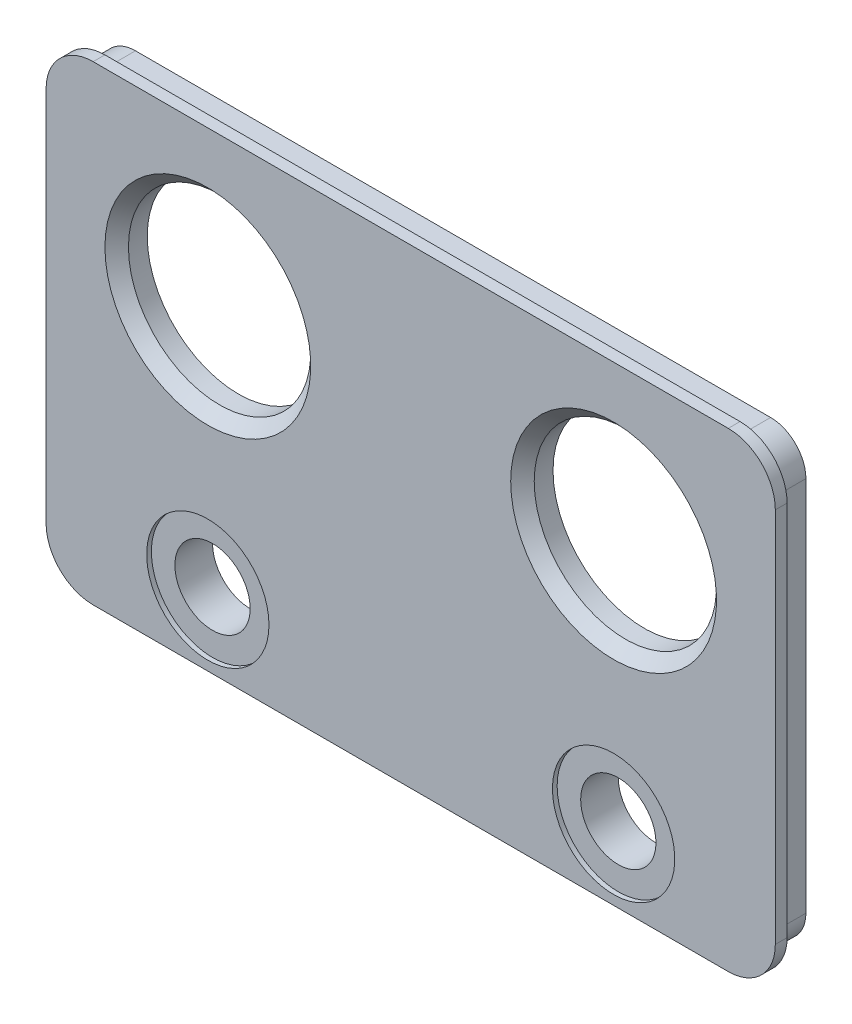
SolidWorks part; units mm, degrees
ref_plane "Front Plane" through (0, 0, 0) normal (0, 0, 1) x (1, 0, 0)
ref_plane "Top Plane" through (0, 0, 0) normal (0, 1, 0) x (1, 0, 0)
ref_plane "Right Plane" through (0, 0, 0) normal (1, 0, 0) x (0, 0, -1)
sketch "Esquisse1" plane through (0, 0, 0) normal (0, 0, 1) x (1, 0, 0)
  line L0 (0, 100) -> (0, -100) construction
  line L1 (-135, -100) -> (135, -100)
  line L2 (-155, -80) -> (-155, 80)
  line L3 (-135, 100) -> (135, 100)
  line L4 (155, -80) -> (155, 80)
  line L5 (-155, -100) -> (155, 100) construction
  line L6 (-155, 100) -> (155, -100) construction
  arc A0 (135, 100) -> (155, 80) centre (135, 80) cw
  arc A1 (135, -100) -> (155, -80) centre (135, -80) ccw
  arc A2 (-135, -100) -> (-155, -80) centre (-135, -80) cw
  arc A3 (-155, 80) -> (-135, 100) centre (-135, 80) cw
  circle A4 centre (-86.25, -70) radius 16
  circle A5 centre (-86.25, 34.25) radius 38.75
  circle A6 centre (86.25, -70) radius 16
  circle A7 centre (86.25, 34.25) radius 38.75
  point P0 (0, 0)
  dimension "D3" = 20
  dimension "D4" = 77.5
  dimension "D7" = 32
  dimension "D1" = 310
  dimension "D2" = 200
  dimension "D5" = 65.75
  dimension "D6" = 68.75
  dimension "D8" = 30
extrude "Boss.-Extru.2" add sketch "Esquisse1" along normal blind 18
sketch "Esquisse2" plane through (0, 0, 18) normal (0, 0, 1) x (1, 0, 0)
  line L0 (0, 100) -> (0, -100) construction
  line L1 (135, 100) -> (-135, 100) construction
  line L2 (-135, -100) -> (135, -100) construction
  circle A6 centre (-86.25, -70) radius 16 construction
  circle A7 centre (-86.25, -70) radius 26
  circle A8 centre (-86.25, -70) radius 26
  circle A9 centre (-86.25, -70) radius 16
  circle A10 centre (86.25, -70) radius 16
  circle A11 centre (86.25, -70) radius 26
  dimension "D1" = 10
extrude "Enlèv. mat.-Extru.1" cut sketch "Esquisse2" against normal blind 2
chamfer "Chanfrein1" distance 5 angle 45 2 edges at (47.5, 34.25, 18) (-47.5, 34.25, 18)
sketch "Esquisse4" plane through (0, 0, 0) normal (0, 0, -1) x (-1, 0, 0)
  line L0 (0, 100) -> (0, -100) construction
  line L1 (-135, 100) -> (135, 100) construction
  line L2 (135, -100) -> (-135, -100) construction
  line L3 (-86.25, 73) -> (-86.25, -4.5) construction
  line L4 (-125, 34.25) -> (-47.5, 34.25) construction
  line L10 (-126.9086, -6.4086) -> (-45.5914, 74.9086) construction
  line L11 (-126.9086, 74.9086) -> (-45.5914, -6.4086) construction
  circle A1 centre (-86.25, 34.25) radius 38.75 construction
  arc A3 (-123.6495, 75.5832) -> (-48.8505, 75.5832) centre (-86.25, -113.3132) cw
  arc A4 (-127.5832, 71.6495) -> (-127.5832, -3.1495) centre (61.3132, 34.25) ccw
  arc A5 (-123.6495, -7.0832) -> (-48.8505, -7.0832) centre (-86.25, 181.8132) ccw
  arc A6 (-44.9168, 71.6495) -> (-44.9168, -3.1495) centre (-233.8132, 34.25) cw
  arc A7 (-48.8505, -7.0832) -> (-44.9168, -3.1495) centre (-49.8216, -2.1784) ccw
  arc A8 (-127.5832, -3.1495) -> (-123.6495, -7.0832) centre (-122.6784, -2.1784) ccw
  arc A9 (-48.8505, 75.5832) -> (-44.9168, 71.6495) centre (-49.8216, 70.6784) cw
  arc A10 (-123.6495, 75.5832) -> (-127.5832, 71.6495) centre (-122.6784, 70.6784) ccw
  arc A11 (123.6495, 75.5832) -> (48.8505, 75.5832) centre (86.25, -113.3132) ccw
  arc A12 (123.6495, 75.5832) -> (127.5832, 71.6495) centre (122.6784, 70.6784) cw
  arc A13 (127.5832, 71.6495) -> (127.5832, -3.1495) centre (-61.3132, 34.25) cw
  arc A14 (127.5832, -3.1495) -> (123.6495, -7.0832) centre (122.6784, -2.1784) cw
  arc A15 (123.6495, -7.0832) -> (48.8505, -7.0832) centre (86.25, 181.8132) cw
  arc A16 (48.8505, -7.0832) -> (44.9168, -3.1495) centre (49.8216, -2.1784) cw
  arc A17 (48.8505, 75.5832) -> (44.9168, 71.6495) centre (49.8216, 70.6784) ccw
  arc A18 (44.9168, 71.6495) -> (44.9168, -3.1495) centre (233.8132, 34.25) ccw
  point P8 (-86.25, 34.25)
  point P20 (-86.25, 79.25)
  point P21 (-86.25, -10.75)
  point P24 (-131.25, 34.25)
  point P25 (-41.25, 34.25)
  dimension "D3" = 115
  dimension "D4" = 5
  dimension "D1" = 90
  dimension "D2" = 90
extrude "Enlèv. mat.-Extru.2" cut sketch "Esquisse4" against normal blind 5
sketch "Esquisse6" plane through (0, 0, 0) normal (0, 0, -1) x (-1, 0, 0)
  line L8 (-150, 80) -> (-150, -80)
  line L9 (-135, -95) -> (135, -95)
  line L10 (150, -80) -> (150, 80)
  line L11 (135, 95) -> (-135, 95)
  line L12 (-150, 80) -> (-150, -80)
  line L13 (-135, -95) -> (135, -95)
  line L14 (150, -80) -> (150, 80)
  line L15 (135, 95) -> (-135, 95)
  line L16 (-155, 80) -> (-155, -80)
  line L17 (-135, -100) -> (135, -100)
  line L18 (155, -80) -> (155, 80)
  line L19 (135, 100) -> (-135, 100)
  line L20 (-155, 80) -> (-155, -80)
  line L21 (-135, -100) -> (135, -100)
  line L22 (155, -80) -> (155, 80)
  line L23 (135, 100) -> (-135, 100)
  arc A8 (-135, 95) -> (-150, 80) centre (-135, 80) ccw
  arc A9 (-150, -80) -> (-135, -95) centre (-135, -80) ccw
  arc A10 (135, -95) -> (150, -80) centre (135, -80) ccw
  arc A11 (150, 80) -> (135, 95) centre (135, 80) ccw
  arc A12 (-135, 95) -> (-150, 80) centre (-135, 80) ccw
  arc A13 (-150, -80) -> (-135, -95) centre (-135, -80) ccw
  arc A14 (135, -95) -> (150, -80) centre (135, -80) ccw
  arc A15 (150, 80) -> (135, 95) centre (135, 80) ccw
  arc A16 (-135, 100) -> (-155, 80) centre (-135, 80) ccw
  arc A17 (-155, -80) -> (-135, -100) centre (-135, -80) ccw
  arc A18 (135, -100) -> (155, -80) centre (135, -80) ccw
  arc A19 (155, 80) -> (135, 100) centre (135, 80) ccw
  arc A20 (-135, 100) -> (-155, 80) centre (-135, 80) ccw
  arc A21 (-155, -80) -> (-135, -100) centre (-135, -80) ccw
  arc A22 (135, -100) -> (155, -80) centre (135, -80) ccw
  arc A23 (155, 80) -> (135, 100) centre (135, 80) ccw
  dimension "D1" = 5
  dimension "D2" = 0
extrude "Enlèv. mat.-Extru.3" cut sketch "Esquisse6" against normal blind 13
